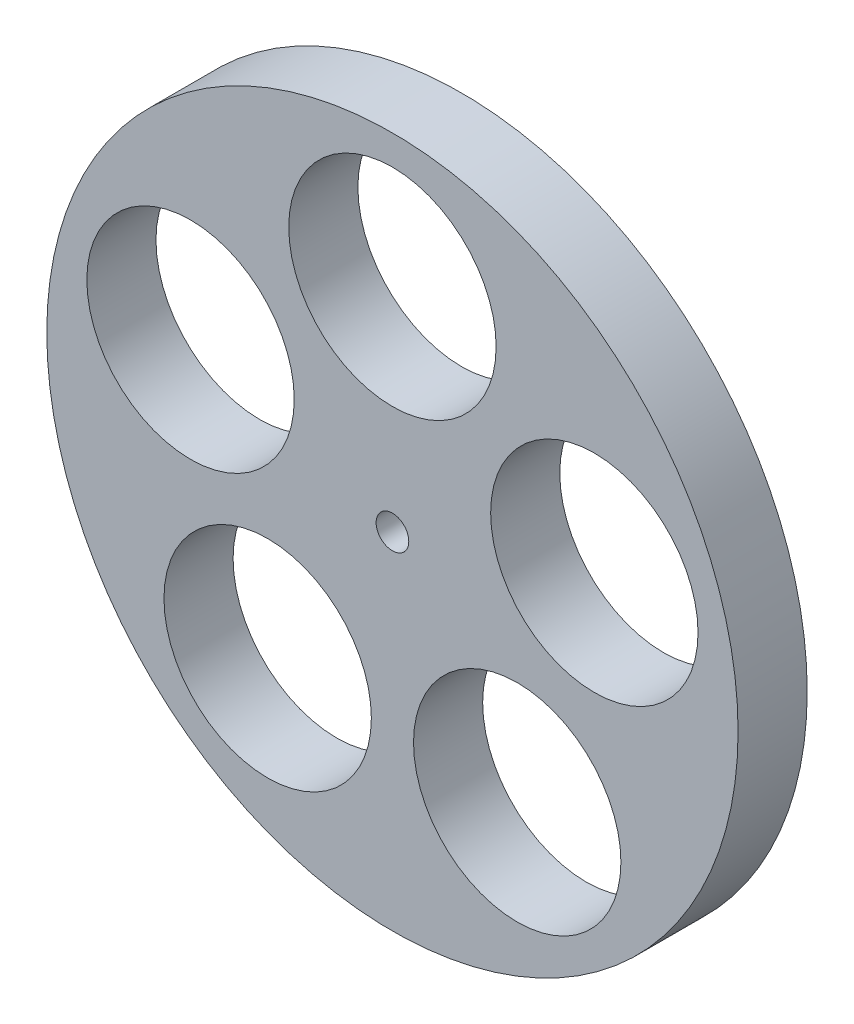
SolidWorks part; units mm, degrees
ref_plane "Front Plane" through (0, 0, 0) normal (0, 0, 1) x (1, 0, 0)
ref_plane "Top Plane" through (0, 0, 0) normal (0, 1, 0) x (1, 0, 0)
ref_plane "Right Plane" through (0, 0, 0) normal (1, 0, 0) x (0, 0, -1)
sketch "Sketch1" plane through (0, 0, 0) normal (0, 0, 1) x (1, 0, 0)
  circle A0 centre (0, 0) radius 63.5
  circle A2 centre (0, 0) radius 3
  circle A3 centre (0, 39) radius 19.05
  circle A4 centre (37.0912, 12.0517) radius 19.05
  circle A5 centre (22.9236, -31.5517) radius 19.05
  circle A6 centre (-22.9236, -31.5517) radius 19.05
  circle A7 centre (-37.0912, 12.0517) radius 19.05
  point P17 (0, 0)
  dimension "D1" = 127
  dimension "D3" = 6
  dimension "D4" = 38.1
  dimension "D5" = 39
  dimension "D6" = 5
extrude "Boss-Extrude1" add sketch "Sketch1" along normal blind 12.7
